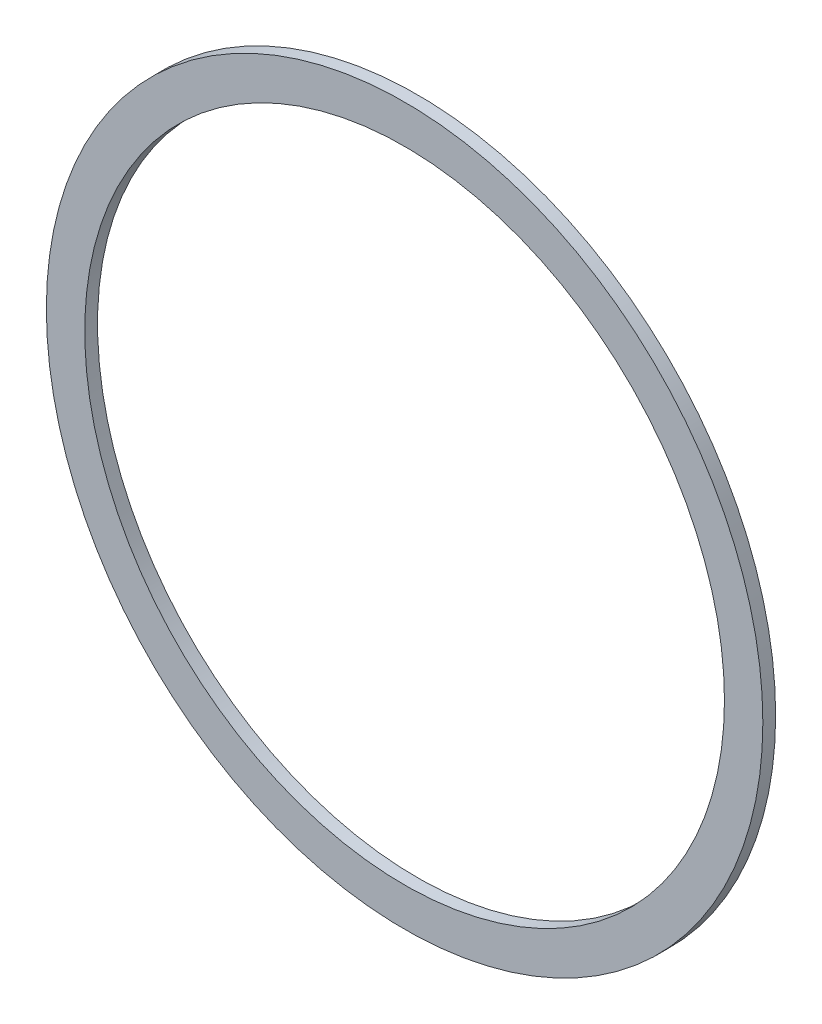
SolidWorks part; units mm, degrees
ref_plane "Спереди" through (0, 0, 0) normal (0, 0, 1) x (1, 0, 0)
ref_plane "Сверху" through (0, 0, 0) normal (0, 1, 0) x (1, 0, 0)
ref_plane "Справа" through (0, 0, 0) normal (1, 0, 0) x (0, 0, -1)
sketch "Эскиз1" plane through (0, 0, 0) normal (0, 0, 1) x (1, 0, 0)
  circle A0 centre (0, 0) radius 28
  circle A1 centre (0, 0) radius 25
  dimension "D1" = 56
  dimension "D2" = 50
extrude "Бобышка-Вытянуть1" add sketch "Эскиз1" along normal blind 1
